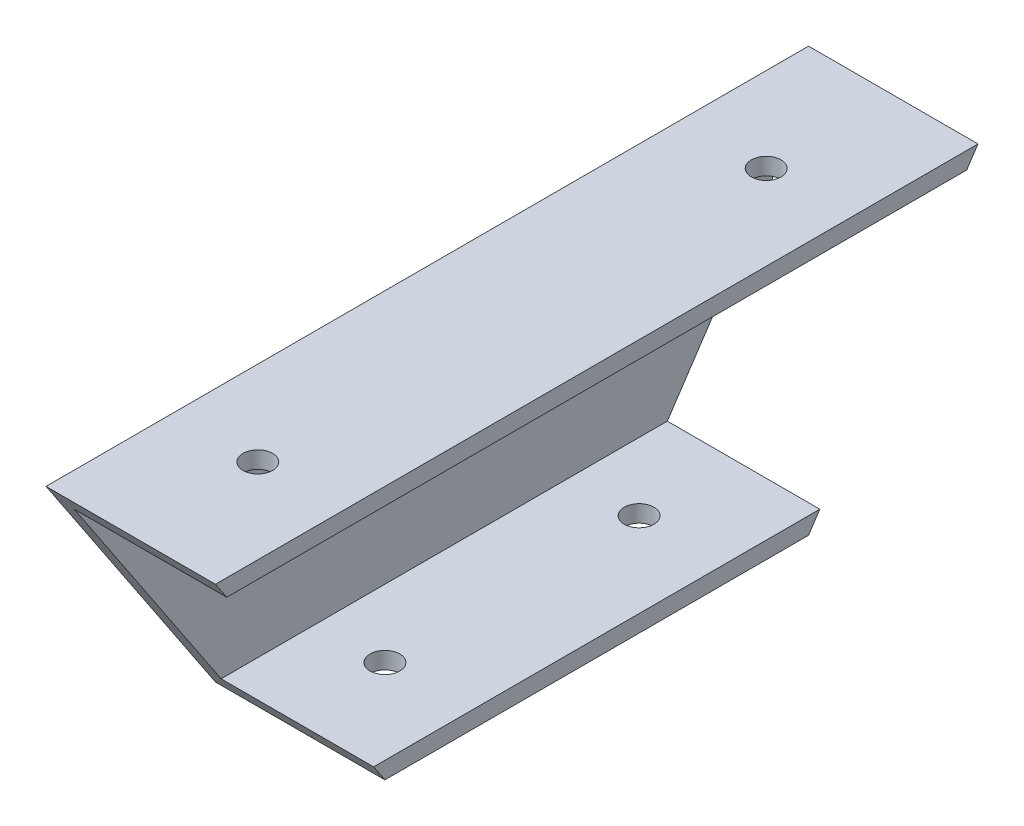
SolidWorks part; units mm, degrees
ref_plane "Front Plane" through (0, 0, 0) normal (0, 0, 1) x (1, 0, 0)
ref_plane "Top Plane" through (0, 0, 0) normal (0, 1, 0) x (1, 0, 0)
ref_plane "Right Plane" through (0, 0, 0) normal (1, 0, 0) x (0, 0, -1)
sketch "Sketch1" plane through (0, 0, 0) normal (0, 0, 1) x (1, 0, 0)
  line L0 (0, 0) -> (20, 0)
  line L1 (20, 0) -> (20, 2)
  line L2 (20, 2) -> (2, 2)
  line L3 (2, 2) -> (2, 28)
  line L4 (2, 28) -> (20, 28)
  line L5 (20, 28) -> (20, 30)
  line L6 (20, 30) -> (0, 30)
  line L7 (0, 30) -> (0, 0)
  dimension "D1" = 2
  dimension "D2" = 2
  dimension "D3" = 2
  dimension "D4" = 30
  dimension "D5" = 20
  dimension "D6" = 20
extrude "Extrude1" add sketch "Sketch1" along normal blind 90
sketch "Sketch3" plane through (2, 0, 0) normal (1, 0, 0) x (0, 0, -1)
  line L0 (-45, 30) -> (-45, 0) construction
  line L1 (-90, 30) -> (0, 30) construction
  line L2 (-90, 0) -> (0, 0) construction
  line L3 (-20, 0) -> (0, 30)
  line L4 (-70, 0) -> (-90, 30)
  line L5 (-90, 30) -> (-90, 0)
  line L6 (-90, 0) -> (-70, 0)
  line L7 (0, 30) -> (0, 0)
  line L8 (0, 0) -> (-20, 0)
  dimension "D1" = 25
  dimension "D2" = 25
extrude "Extrude2" cut sketch "Sketch3" against normal mid plane 90
sketch "Sketch4" plane through (0, 0, 0) normal (0, -1, 0) x (1, 0, 0)
  line L0 (20, 45) -> (0, 45) construction
  line L1 (20, 70) -> (20, 20) construction
  line L2 (0, 70) -> (0, 20) construction
  line L3 (10, 20) -> (10, 70) construction
  line L4 (0, 20) -> (20, 20) construction
  line L5 (0, 70) -> (20, 70) construction
  circle A0 centre (10, 30) radius 1.75
  circle A1 centre (10, 60) radius 1.75
  dimension "D1" = 3.5
  dimension "D2" = 15
  dimension "D3" = 15
extrude "Extrude3" cut sketch "Sketch4" against normal blind 10
sketch "Sketch5" plane through (0, 28, 0) normal (0, -1, 0) x (1, 0, 0)
  line L0 (20, 45) -> (2, 45) construction
  line L1 (20, 88.6667) -> (20, 1.3333) construction
  line L2 (2, 88.6667) -> (2, 1.3333) construction
  line L3 (10, 1.3333) -> (10, 88.6667) construction
  line L4 (2, 1.3333) -> (20, 1.3333) construction
  line L5 (20, 88.6667) -> (2, 88.6667) construction
  circle A0 centre (10, 15) radius 1.75
  circle A1 centre (10, 75) radius 1.75
  dimension "D2" = 3.5
  dimension "D3" = 30
  dimension "D4" = 30
  dimension "D1" = 10
extrude "Extrude4" cut sketch "Sketch5" against normal blind 10
